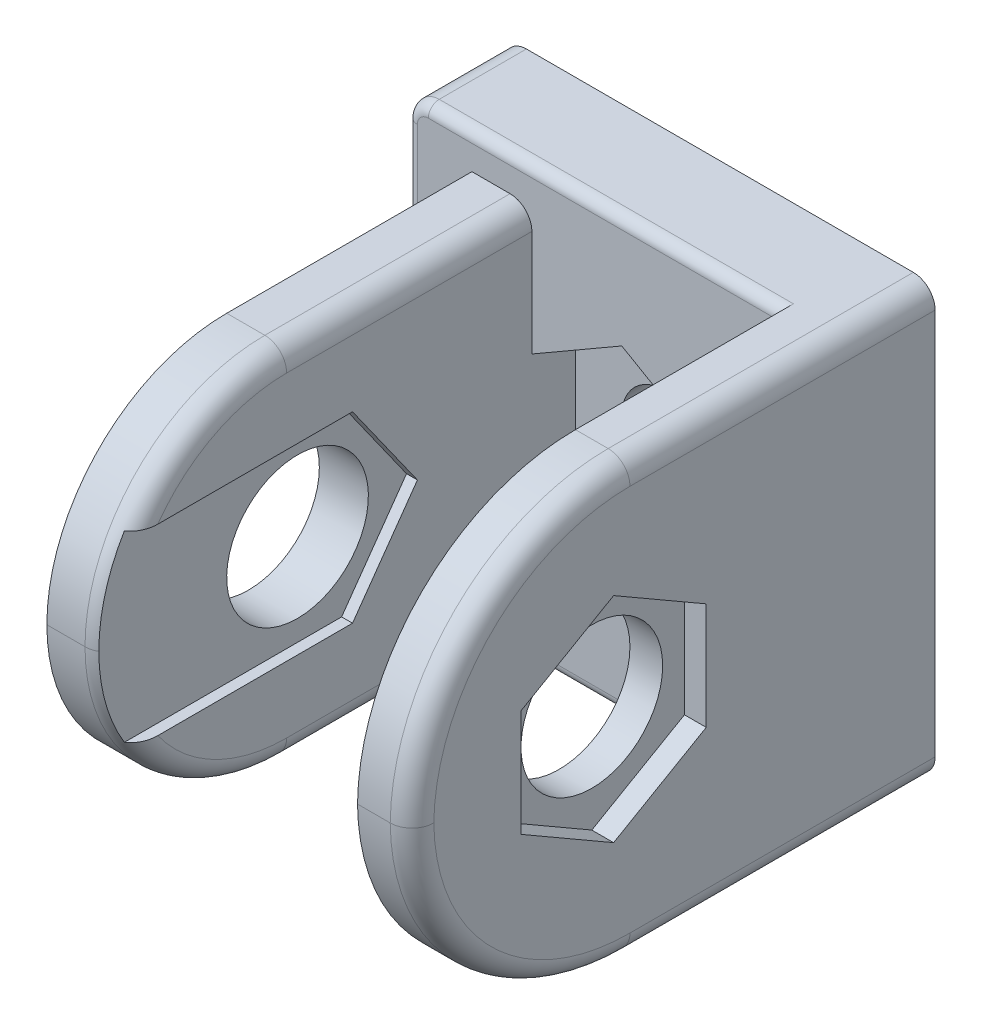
SolidWorks part; units mm, degrees
ref_plane "Спереди" through (0, 0, 0) normal (0, 0, 1) x (1, 0, 0)
ref_plane "Сверху" through (0, 0, 0) normal (0, 1, 0) x (1, 0, 0)
ref_plane "Справа" through (0, 0, 0) normal (1, 0, 0) x (0, 0, -1)
sketch "Эскиз1" plane through (0, 0, 0) normal (0, 0, 1) x (1, 0, 0)
  line L1 (-19.75, 19.75) -> (19.75, 19.75)
  line L2 (-19.75, 19.75) -> (-19.75, -19.75)
  line L3 (-19.75, -19.75) -> (19.75, -19.75)
  line L4 (19.75, 19.75) -> (19.75, -19.75)
  line L5 (-19.75, 19.75) -> (19.75, -19.75) construction
  line L6 (-19.75, -19.75) -> (19.75, 19.75) construction
  point P0 (0, 0)
  dimension "D1" = 39.5
extrude "Бобышка-Вытянуть1" add sketch "Эскиз1" along normal blind 9
sketch "Эскиз2" plane through (0, 0, 9) normal (0, 0, 1) x (1, 0, 0)
  line L0 (19.75, 19.75) -> (-19.75, 19.75) construction
  line L1 (14.75, 19.75) -> (19.75, 19.75)
  line L2 (14.75, 19.75) -> (14.75, -19.75)
  line L3 (14.75, -19.75) -> (19.75, -19.75)
  line L4 (19.75, 19.75) -> (19.75, -19.75)
  line L5 (14.75, 19.75) -> (19.75, -19.75) construction
  line L6 (14.75, -19.75) -> (19.75, 19.75) construction
  line L8 (-13.75, 16.5) -> (-8.25, 16.5)
  line L9 (-13.75, 16.5) -> (-13.75, -16.5)
  line L10 (-13.75, -16.5) -> (-8.25, -16.5)
  line L11 (-8.25, 16.5) -> (-8.25, -16.5)
  line L12 (-13.75, 16.5) -> (-8.25, -16.5) construction
  line L13 (-13.75, -16.5) -> (-8.25, 16.5) construction
  point P0 (17.25, 0)
  point P8 (-11, 0)
  dimension "D1" = 5
  dimension "D2" = 23
  dimension "D3" = 5.5
  dimension "D4" = 33
extrude "Бобышка-Вытянуть2" add sketch "Эскиз2" along normal blind 39
fillet "Скругление1" radius 20 2 edges at (17.25, 19.75, 48) (17.25, -19.75, 48)
fillet "Скругление2" radius 16.5 2 edges at (-11, 16.5, 48) (-11, -16.5, 48)
sketch "Эскиз4" plane through (19.75, 0, 0) normal (1, 0, 0) x (0, 0, -1)
  line L0 (0, -19.75) -> (0, 19.75) construction
  line L1 (-29.5005, -9.815) -> (-21.0005, -4.9075)
  line L2 (-21.0005, -4.9075) -> (-21.0005, 4.9075)
  line L3 (-21.0005, 4.9075) -> (-29.5005, 9.815)
  line L4 (-29.5005, 9.815) -> (-38.0005, 4.9075)
  line L5 (-38.0005, 4.9075) -> (-38.0005, -4.9075)
  line L6 (-38.0005, -4.9075) -> (-29.5005, -9.815)
  circle A1 centre (-29.5005, 0) radius 8.5 construction
  dimension "D1" = 17
  dimension "D2" = 18.4979
extrude "Вырез-Вытянуть1" cut sketch "Эскиз4" against normal blind 2
sketch "Эскиз5" plane through (17.75, 0, 0) normal (1, 0, 0) x (0, 0, -1)
  circle A0 centre (-29.5005, 0) radius 6.5
  dimension "D1" = 13
extrude "Вырез-Вытянуть2" cut sketch "Эскиз5" against normal up to surface (31.5 mm away)
sketch "Эскиз7" plane through (-8.25, 0, 0) normal (1, 0, 0) x (0, 0, -1)
  line L0 (-45.7018, 8.4) -> (-25.456, 8.4)
  line L1 (-25.456, 8.4) -> (-19.5005, 0)
  line L2 (-48, 0) -> (-19.5005, 0) construction
  line L3 (-45.7018, -8.4) -> (-25.456, -8.4)
  line L4 (-25.456, -8.4) -> (-19.5005, 0)
  line L5 (-24.9043, 4.5962) -> (-21.6457, 0) construction
  line L7 (-29.5005, 0) -> (-24.9043, 4.5962) construction
  arc A0 (-31.5, 16.5) -> (-48, 0) centre (-31.5, 0) ccw construction
  arc A1 (-45.7018, -8.4) -> (-45.7018, 8.4) centre (-31.5, 0) cw
  circle A2 centre (-29.5005, 0) radius 6.5 construction
  point P21 (-48, 0)
  dimension "D2" = 3.5
  dimension "D3" = 3.5
  dimension "D1" = 16.8
  dimension "D4" = 45
extrude "Вырез-Вытянуть3" cut sketch "Эскиз7" against normal blind 1
sketch "Эскиз8" plane through (0, 0, 9) normal (0, 0, 1) x (1, 0, 0)
  line L0 (-8.25, -16.5) -> (-8.25, 16.5) construction
  line L1 (-8.25, 4.7631) -> (-8.25, -4.7631)
  line L2 (-8.25, -4.7631) -> (0, -9.5263)
  line L3 (0, -9.5263) -> (8.25, -4.7631)
  line L4 (8.25, -4.7631) -> (8.25, 4.7631)
  line L5 (8.25, 4.7631) -> (0, 9.5263)
  line L6 (0, 9.5263) -> (-8.25, 4.7631)
  circle A0 centre (0, 0) radius 8.25 construction
extrude "Вырез-Вытянуть4" cut sketch "Эскиз8" against normal blind 4
sketch "Эскиз9" plane through (0, 0, 5) normal (0, 0, 1) x (1, 0, 0)
  circle A0 centre (0, 0) radius 4
  dimension "D1" = 8
extrude "Вырез-Вытянуть5" cut sketch "Эскиз9" against normal up to surface (5 mm away)
sketch "Эскиз10" plane through (0, 0, 0) normal (0, 0, -1) x (-1, 0, 0)
  line L0 (0, 19.75) -> (0, -19.75) construction
  line L1 (-19.75, 19.75) -> (19.75, 19.75) construction
  line L3 (-8, 17.75) -> (8, 17.75)
  line L4 (8, 17.75) -> (8, 14.75)
  line L5 (7, 13.75) -> (5, 13.75)
  line L6 (4, 12.75) -> (4, 10.75)
  line L7 (3, 9.75) -> (-3, 9.75)
  line L8 (-4, 10.75) -> (-4, 12.75)
  line L9 (-5, 13.75) -> (-7, 13.75)
  line L10 (-8, 14.75) -> (-8, 17.75)
  line L35 (19.75, -19.75) -> (-19.75, -19.75) construction
  line L59 (17.75, 8) -> (17.75, -8)
  line L60 (17.75, -8) -> (14.75, -8)
  line L61 (13.75, -7) -> (13.75, -5)
  line L62 (12.75, -4) -> (10.75, -4)
  line L63 (9.75, -3) -> (9.75, 3)
  line L64 (10.75, 4) -> (12.75, 4)
  line L65 (13.75, 5) -> (13.75, 7)
  line L66 (14.75, 8) -> (17.75, 8)
  line L67 (8, -17.75) -> (-8, -17.75)
  line L68 (-8, -17.75) -> (-8, -14.75)
  line L69 (-7, -13.75) -> (-5, -13.75)
  line L70 (-4, -12.75) -> (-4, -10.75)
  line L71 (-3, -9.75) -> (3, -9.75)
  line L72 (4, -10.75) -> (4, -12.75)
  line L73 (5, -13.75) -> (7, -13.75)
  line L74 (8, -14.75) -> (8, -17.75)
  line L75 (-17.75, -8) -> (-17.75, 8)
  line L76 (-17.75, 8) -> (-14.75, 8)
  line L77 (-13.75, 7) -> (-13.75, 5)
  line L78 (-12.75, 4) -> (-10.75, 4)
  line L79 (-9.75, 3) -> (-9.75, -3)
  line L80 (-10.75, -4) -> (-12.75, -4)
  line L81 (-13.75, -5) -> (-13.75, -7)
  line L82 (-14.75, -8) -> (-17.75, -8)
  arc A0 (8, 14.75) -> (7, 13.75) centre (7, 14.75) cw
  arc A1 (5, 13.75) -> (4, 12.75) centre (5, 12.75) ccw
  arc A2 (4, 10.75) -> (3, 9.75) centre (3, 10.75) cw
  arc A3 (-3, 9.75) -> (-4, 10.75) centre (-3, 10.75) cw
  arc A4 (-4, 12.75) -> (-5, 13.75) centre (-5, 12.75) ccw
  arc A5 (-7, 13.75) -> (-8, 14.75) centre (-7, 14.75) cw
  arc A24 (14.75, -8) -> (13.75, -7) centre (14.75, -7) cw
  arc A25 (13.75, -5) -> (12.75, -4) centre (12.75, -5) ccw
  arc A26 (10.75, -4) -> (9.75, -3) centre (10.75, -3) cw
  arc A27 (9.75, 3) -> (10.75, 4) centre (10.75, 3) cw
  arc A28 (12.75, 4) -> (13.75, 5) centre (12.75, 5) ccw
  arc A29 (13.75, 7) -> (14.75, 8) centre (14.75, 7) cw
  arc A30 (-8, -14.75) -> (-7, -13.75) centre (-7, -14.75) cw
  arc A31 (-5, -13.75) -> (-4, -12.75) centre (-5, -12.75) ccw
  arc A32 (-4, -10.75) -> (-3, -9.75) centre (-3, -10.75) cw
  arc A33 (3, -9.75) -> (4, -10.75) centre (3, -10.75) cw
  arc A34 (4, -12.75) -> (5, -13.75) centre (5, -12.75) ccw
  arc A35 (7, -13.75) -> (8, -14.75) centre (7, -14.75) cw
  arc A36 (-14.75, 8) -> (-13.75, 7) centre (-14.75, 7) cw
  arc A37 (-13.75, 5) -> (-12.75, 4) centre (-12.75, 5) ccw
  arc A38 (-10.75, 4) -> (-9.75, 3) centre (-10.75, 3) cw
  arc A39 (-9.75, -3) -> (-10.75, -4) centre (-10.75, -3) cw
  arc A40 (-12.75, -4) -> (-13.75, -5) centre (-12.75, -5) ccw
  arc A41 (-13.75, -7) -> (-14.75, -8) centre (-14.75, -7) cw
  point P8 (0, 17.75)
  point P15 (0, 9.75)
  point P55 (-8, 13.75)
  point P92 (0, 0)
  dimension "D6" = 1
  dimension "D1" = 16
  dimension "D2" = 4
  dimension "D3" = 4
  dimension "D4" = 2
  dimension "D5" = 8
  dimension "D7" = 4
extrude "Вырез-Вытянуть6" cut sketch "Эскиз10" against normal blind 6.5
fillet "Скругление3" radius 2 10 edges at (-8.25, 14.3327, 39.6747) (-8.25, -14.3327, 39.6747) (19.75, -19.75, 14) (-8.25, 16.5, 20.25) (-8.25, -16.5, 20.25) (19.75, -13.9802, 42.0535) (19.75, 13.9802, 42.0535) (19.75, 19.75, 14) (-19.75, -19.75, 4.5) (-19.75, 19.75, 4.5)
fillet "Скругление4" radius 1 5 edges at (-1.5, 19.75, 9) (-19.75, 0, 9) (-1.5, -19.75, 9) (-19.1642, 19.1642, 9) (-19.1642, -19.1642, 9)
